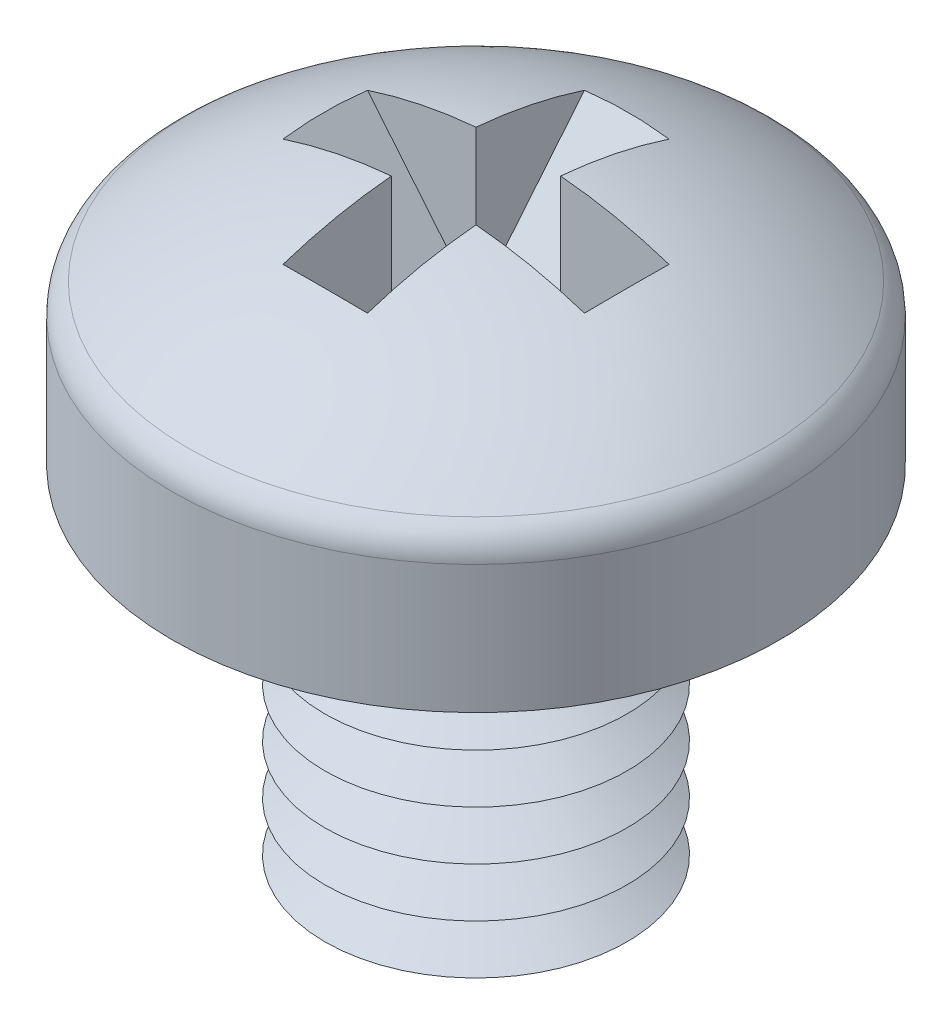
SolidWorks part; units mm, degrees
ref_plane "Front" through (0, 0, 0) normal (0, 0, 1) x (1, 0, 0)
ref_plane "Top" through (0, 0, 0) normal (0, 1, 0) x (1, 0, 0)
ref_plane "Side" through (0, 0, 0) normal (1, 0, 0) x (0, 0, -1)
sketch "Sketch1" plane through (0, 0, 0) normal (0, 0, 1) x (1, 0, 0)
  line L0 (0, 0) -> (2.5132, 0)
  line L1 (2.5132, 0) -> (2.5132, 1.0617)
  line L2 (0, 2.1) -> (0, 0)
  line L3 (0, 0) -> (0, 100) construction
  arc A0 (2.5132, 1.0617) -> (2.3862, 1.3135) centre (2.2, 1.0617) ccw
  arc A1 (2.3862, 1.3135) -> (0, 2.1) centre (0, -1.9132) ccw
revolve "Base-Revolve" add sketch "Sketch1" angle 360 about L3
sketch "Sketch2" plane through (0, 0, 0) normal (0, 0, 1) x (1, 0, 0)
  line L0 (0, 0) -> (0, 100) construction
  line L1 (0, -3) -> (0.8964, -3)
  line L2 (0.8964, -3) -> (1.25, -2.7958)
  line L3 (1.25, -2.7958) -> (0.8964, -2.5917)
  line L4 (0.8964, -2.5917) -> (1.25, -2.3875)
  line L5 (1.25, -2.3875) -> (0.8964, -2.1833)
  line L6 (0.8964, -2.1833) -> (1.25, -1.9792)
  line L7 (1.25, -1.9792) -> (0.8964, -1.775)
  line L8 (0.8964, -1.775) -> (1.25, -1.5708)
  line L9 (1.25, -1.5708) -> (0.8964, -1.3666)
  line L10 (0.8964, -1.3666) -> (1.25, -1.1625)
  line L11 (1.25, -1.1625) -> (0.8964, -0.9583)
  line L12 (0.8964, -0.9583) -> (1.25, -0.7541)
  line L13 (1.25, -0.7541) -> (0.8964, -0.55)
  line L14 (0.8964, -0.55) -> (1.25, -0.3458)
  line L15 (1.25, -0.3458) -> (0.8964, -0.1416)
  line L16 (0.8964, -0.1416) -> (1.25, -0.1416)
  line L17 (1.25, -0.1416) -> (1.25, 0)
  line L18 (1.25, 0) -> (0, 0)
  line L19 (0, 0) -> (0, -3)
revolve "Boss-Revolve1" add sketch "Sketch2" angle 360 about L0
sketch "Sketch3" plane through (0, 0, 0) normal (0, 0, 1) x (1, 0, 0)
  line L0 (-1.425, 3.15) -> (1.425, 3.15)
  line L1 (1.425, 3.15) -> (1.425, 2.1)
  line L2 (1.425, 2.1) -> (0, 0.37)
  line L3 (0, 0.37) -> (-1.425, 2.1)
  line L4 (-1.425, 2.1) -> (-1.425, 3.15)
extrude "Cut-Extrude1" cut sketch "Sketch3" against normal mid plane 0.7
sketch "Sketch4" plane through (0, 0, 0) normal (1, 0, 0) x (0, 0, -1)
  line L0 (-1.425, 3.15) -> (1.425, 3.15)
  line L1 (1.425, 3.15) -> (1.425, 2.1)
  line L2 (1.425, 2.1) -> (0, 0.37)
  line L3 (0, 0.37) -> (-1.425, 2.1)
  line L4 (-1.425, 2.1) -> (-1.425, 3.15)
extrude "Cut-Extrude2" cut sketch "Sketch4" against normal mid plane 0.7
